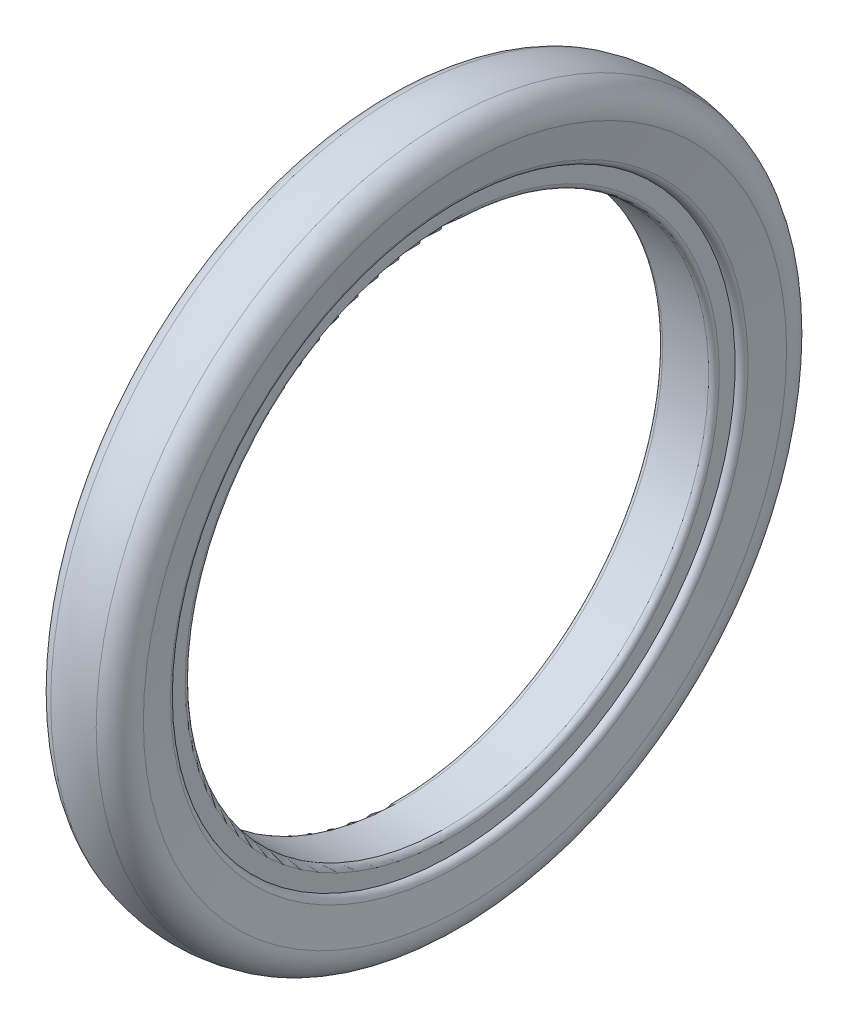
SolidWorks part; units mm, degrees
ref_plane "Front Plane" through (0, 0, 0) normal (0, 0, 1) x (1, 0, 0)
ref_plane "Top Plane" through (0, 0, 0) normal (0, 1, 0) x (1, 0, 0)
ref_plane "Right Plane" through (0, 0, 0) normal (1, 0, 0) x (0, 0, -1)
sketch "Sketch1" plane through (0, 0, 0) normal (0, 0, 1) x (1, 0, 0)
  line L0 (0, 0) -> (54.4838, 0) construction
  line L1 (-25.4, 254) -> (-25.4, 239.7252)
  line L2 (-20.6248, 234.95) -> (20.6248, 234.95)
  line L3 (25.4, 239.7252) -> (25.4, 254)
  line L4 (-36.8068, 288.7586) -> (-31.6553, 259.2577)
  line L5 (36.8068, 288.7586) -> (31.6553, 259.2577)
  line L6 (0, 0) -> (0, 74.5651) construction
  line L7 (-25.4, 254) -> (25.4, 254)
  arc A0 (-20.4107, 314.7155) -> (-36.8068, 288.7586) centre (-14.2875, 292.6909) ccw
  arc A1 (20.4107, 314.7155) -> (-20.4107, 314.7155) centre (0, 241.3) ccw
  arc A2 (-31.6553, 259.2577) -> (-25.4, 254) centre (-25.4, 260.35) ccw
  arc A3 (20.4107, 314.7155) -> (36.8068, 288.7586) centre (14.2875, 292.6909) cw
  arc A4 (31.6553, 259.2577) -> (25.4, 254) centre (25.4, 260.35) cw
  arc A5 (20.6248, 234.95) -> (25.4, 239.7252) centre (20.6248, 239.7252) ccw
  arc A6 (-25.4, 239.7252) -> (-20.6248, 234.95) centre (-20.6248, 239.7252) ccw
  point P21 (25.4, 234.95)
  point P24 (-25.4, 234.95)
  dimension "D2" = 22.86
  dimension "D4" = 76.2
  dimension "D6" = 6.35
  dimension "D9" = 4.7752
  dimension "D10" = 74.295
  dimension "D7" = 635
  dimension "D1" = 50.8
  dimension "D3" = 19.05
  dimension "D5" = 234.95
  dimension "D8" = 28.575
  dimension "D11" = 508
sketch "Sketch2" plane through (0, 0, 0) normal (0, 0, 1) x (1, 0, 0)
  line L0 (-20.6248, 234.95) -> (20.6248, 234.95) construction
  line L1 (25.4, 239.7252) -> (25.4, 254) construction
  line L2 (-25.4, 254) -> (25.4, 254) construction
  line L3 (-25.4, 254) -> (-25.4, 239.7252) construction
  line L4 (-20.6248, 234.95) -> (20.6248, 234.95)
  line L5 (25.4, 239.7252) -> (25.4, 254)
  line L6 (-25.4, 254) -> (25.4, 254)
  line L7 (-25.4, 254) -> (-25.4, 239.7252)
  arc A0 (20.6248, 234.95) -> (25.4, 239.7252) centre (20.6248, 239.7252) ccw construction
  arc A1 (-25.4, 239.7252) -> (-20.6248, 234.95) centre (-20.6248, 239.7252) ccw construction
  arc A2 (20.6248, 234.95) -> (25.4, 239.7252) centre (20.6248, 239.7252) ccw
  arc A3 (-25.4, 239.7252) -> (-20.6248, 234.95) centre (-20.6248, 239.7252) ccw
revolve "Revolve1" add sketch "Sketch2" angle 360 about L0
sketch "Sketch3" plane through (0, 0, 0) normal (0, 0, 1) x (1, 0, 0)
  line L0 (-25.4, 254) -> (25.4, 254) construction
  line L1 (36.8068, 288.7586) -> (31.6553, 259.2577) construction
  line L2 (-36.8068, 288.7586) -> (-31.6553, 259.2577) construction
  line L3 (-25.4, 254) -> (25.4, 254)
  line L4 (36.8068, 288.7586) -> (31.6553, 259.2577)
  line L5 (-36.8068, 288.7586) -> (-31.6553, 259.2577)
  arc A0 (25.4, 254) -> (31.6553, 259.2577) centre (25.4, 260.35) ccw construction
  arc A1 (36.8068, 288.7586) -> (20.4107, 314.7155) centre (14.2875, 292.6909) ccw construction
  arc A2 (20.4107, 314.7155) -> (-20.4107, 314.7155) centre (0, 241.3) ccw construction
  arc A3 (-20.4107, 314.7155) -> (-36.8068, 288.7586) centre (-14.2875, 292.6909) ccw construction
  arc A4 (-31.6553, 259.2577) -> (-25.4, 254) centre (-25.4, 260.35) ccw construction
  arc A5 (25.4, 254) -> (31.6553, 259.2577) centre (25.4, 260.35) ccw
  arc A6 (36.8068, 288.7586) -> (20.4107, 314.7155) centre (14.2875, 292.6909) ccw
  arc A7 (20.4107, 314.7155) -> (-20.4107, 314.7155) centre (0, 241.3) ccw
  arc A8 (-20.4107, 314.7155) -> (-36.8068, 288.7586) centre (-14.2875, 292.6909) ccw
  arc A9 (-31.6553, 259.2577) -> (-25.4, 254) centre (-25.4, 260.35) ccw
revolve "Revolve2" add sketch "Sketch3" angle 360 about L0
sketch "Sketch4" plane through (0, 0, 0) normal (1, 0, 0) x (0, 0, -1)
  circle A0 centre (0, 0) radius 7
  dimension "D1" = 14
